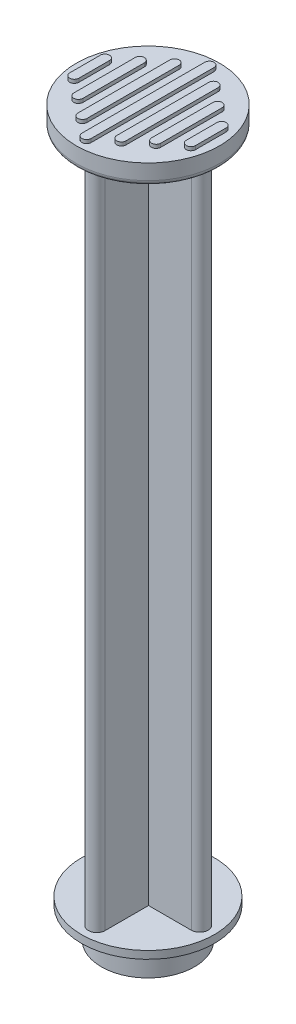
SolidWorks part; units mm, degrees
ref_plane "Front Plane" through (0, 0, 0) normal (0, 0, 1) x (1, 0, 0)
ref_plane "Top Plane" through (0, 0, 0) normal (0, 1, 0) x (1, 0, 0)
ref_plane "Right Plane" through (0, 0, 0) normal (1, 0, 0) x (0, 0, -1)
sketch "Sketch1" plane through (0, 0, 0) normal (0, 1, 0) x (1, 0, 0)
  circle A0 centre (0, 0) radius 4.55
  dimension "D1" = 9.1
extrude "Boss-Extrude1" add sketch "Sketch1" along normal blind 1.83
sketch "Sketch3" plane through (0, 1.83, 0) normal (0, 1, 0) x (1, 0, 0)
  circle A0 centre (0, 0) radius 2.47
  dimension "D1" = 4.94
extrude "Boss-Extrude2" add sketch "Sketch3" along normal blind 1.13
sketch "Sketch4" plane through (0, 2.96, 0) normal (0, 1, 0) x (1, 0, 0)
  circle A0 centre (0, 0) radius 6.5
  dimension "D1" = 13
extrude "Boss-Extrude3" add sketch "Sketch4" along normal blind 0.75
sketch "Sketch5" plane through (0, 3.71, 0) normal (0, 1, 0) x (1, 0, 0)
  line L0 (0, 5) -> (0, 0.7631) construction
  line L3 (0.8193, 5) -> (0.8193, 0.8769)
  line L10 (-0.8193, 5) -> (-0.8193, 0.8769)
  line L11 (5, 0.0569) -> (-5, 0.0569) construction
  line L12 (5, -0.7631) -> (0.8193, -0.7631)
  line L13 (5, 0.8769) -> (0.8193, 0.8769)
  line L14 (-0.8193, 0.8769) -> (-5, 0.8769)
  line L15 (-0.8193, -0.7631) -> (-0.8193, -5)
  line L16 (0.8193, -0.7631) -> (0.8193, -5)
  line L17 (0, 0.0569) -> (0, -5) construction
  line L18 (-0.8193, -0.7631) -> (-5, -0.7631)
  arc A4 (0.8193, 5) -> (-0.8193, 5) centre (0, 5) ccw
  arc A5 (-0.8193, -5) -> (0.8193, -5) centre (0, -5) ccw
  arc A6 (5, -0.7631) -> (5, 0.8769) centre (5, 0.0569) ccw
  arc A7 (-5, 0.8769) -> (-5, -0.7631) centre (-5, 0.0569) ccw
  point P2 (0, 0)
  point P9 (0, 0)
  dimension "D1" = 10
  dimension "D2" = 10
  dimension "D3" = 1.6387
  dimension "D4" = 1.64
extrude "Boss-Extrude4" add sketch "Sketch5" along normal blind 65
sketch "Sketch6" plane through (0, 68.71, 0) normal (0, 1, 0) x (1, 0, 0)
  circle A0 centre (0, 0) radius 7
  dimension "D1" = 14
extrude "Boss-Extrude5" add sketch "Sketch6" along normal blind 2
fillet "Fillet4" radius 0.5 1 edges at (0, 68.71, 7)
sketch "Sketch7" plane through (0, 70.71, 0) normal (0, 1, 0) x (1, 0, 0)
  line L0 (0, 11.1307) -> (0, -11.8295) construction
  line L1 (0, -6) -> (0, 6) construction
  line L2 (-0.45, -6) -> (-0.45, 6)
  line L3 (0.45, -6) -> (0.45, 6)
  line L4 (1.9, 4.5) -> (1.9, -4.5) construction
  line L5 (2.35, 4.5) -> (2.35, -4.5)
  line L6 (1.45, 4.5) -> (1.45, -4.5)
  line L7 (5.7, 1.5) -> (5.7, -1.5) construction
  line L8 (6.15, 1.5) -> (6.15, -1.5)
  line L9 (5.25, 1.5) -> (5.25, -1.5)
  line L10 (3.8, 3) -> (3.8, -3) construction
  line L11 (4.25, 3) -> (4.25, -3)
  line L12 (3.35, 3) -> (3.35, -3)
  line L13 (-15.4399, 0) -> (19.2399, 0) construction
  line L14 (-5.7, 1.5) -> (-5.7, -1.5) construction
  line L15 (-6.15, 1.5) -> (-6.15, -1.5)
  line L16 (-5.25, 1.5) -> (-5.25, -1.5)
  line L17 (-3.8, 3) -> (-3.8, -3) construction
  line L18 (-4.25, 3) -> (-4.25, -3)
  line L19 (-3.35, 3) -> (-3.35, -3)
  line L20 (-1.9, 4.5) -> (-1.9, -4.5) construction
  line L21 (-2.35, 4.5) -> (-2.35, -4.5)
  line L22 (-1.45, 4.5) -> (-1.45, -4.5)
  arc A0 (-0.45, -6) -> (0.45, -6) centre (0, -6) ccw
  arc A1 (0.45, 6) -> (-0.45, 6) centre (0, 6) ccw
  arc A2 (2.35, 4.5) -> (1.45, 4.5) centre (1.9, 4.5) ccw
  arc A3 (1.45, -4.5) -> (2.35, -4.5) centre (1.9, -4.5) ccw
  arc A4 (6.15, 1.5) -> (5.25, 1.5) centre (5.7, 1.5) ccw
  arc A5 (5.25, -1.5) -> (6.15, -1.5) centre (5.7, -1.5) ccw
  arc A6 (4.25, 3) -> (3.35, 3) centre (3.8, 3) ccw
  arc A7 (3.35, -3) -> (4.25, -3) centre (3.8, -3) ccw
  arc A9 (-6.15, 1.5) -> (-5.25, 1.5) centre (-5.7, 1.5) cw
  arc A10 (-5.25, -1.5) -> (-6.15, -1.5) centre (-5.7, -1.5) cw
  arc A11 (-4.25, 3) -> (-3.35, 3) centre (-3.8, 3) cw
  arc A12 (-3.35, -3) -> (-4.25, -3) centre (-3.8, -3) cw
  arc A13 (-2.35, 4.5) -> (-1.45, 4.5) centre (-1.9, 4.5) cw
  arc A14 (-1.45, -4.5) -> (-2.35, -4.5) centre (-1.9, -4.5) cw
  point P5 (0, 0)
  point P12 (1.9, 0)
  point P19 (5.7, 0)
  point P26 (3.8, 0)
  point P42 (-5.7, 0)
  point P49 (-3.8, 0)
  point P56 (-1.9, 0)
  dimension "D1" = 12
  dimension "D2" = 9
  dimension "D3" = 6
  dimension "D4" = 3
  dimension "D5" = 0.9
  dimension "D6" = 0.9
  dimension "D7" = 1
  dimension "D8" = 1
  dimension "D9" = 0.9
  dimension "D10" = 0.9
  dimension "D11" = 1
extrude "Boss-Extrude6" add sketch "Sketch7" along normal blind 0.35
